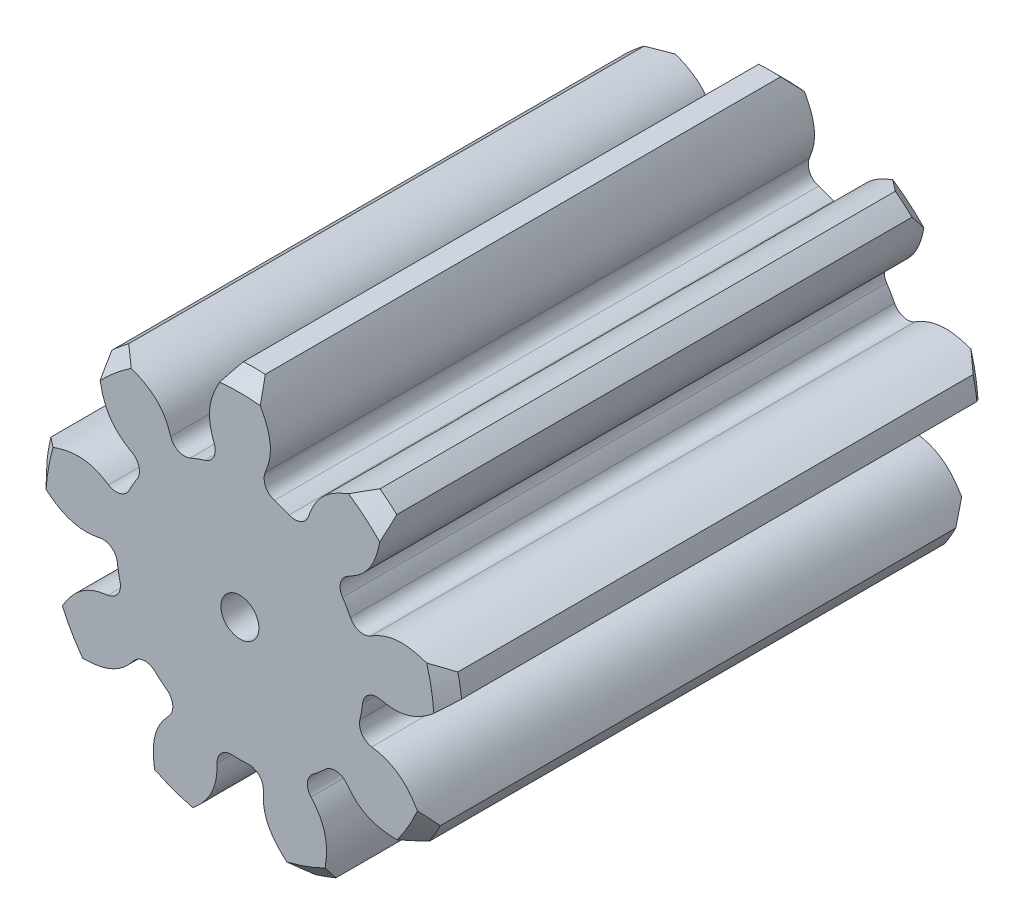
SolidWorks part; units mm, degrees
ref_plane "Plan1" through (0, 0, 0) normal (0, 0, 1) x (1, 0, 0)
ref_plane "Plan2" through (0, 0, 0) normal (0, 1, 0) x (1, 0, 0)
ref_plane "Plan3" through (0, 0, 0) normal (1, 0, 0) x (0, 0, -1)
sketch "Dent" plane through (0, 0, 0) normal (0, 0, 1) x (1, 0, 0)
  line L1 (-0.4322, 4.2181) -> (0, 3.0307)
  line L3 (0, 8.25) -> (0, -8.25) construction
  line L4 (0, 0) -> (0.4322, 8.2387) construction
  line L5 (1.1781, 6.6464) -> (-1.1781, 6.6464) construction
  line L6 (1.2, 6.2284) -> (-1.2, 6.2284) construction
  line L7 (-0.75, 0) -> (0.75, 0) construction
  line L9 (0.4322, 4.2181) -> (0, 3.0307)
  line L11 (0, 0) -> (1.1781, 6.6464) construction
  line L12 (0, 0) -> (1.2, 6.2284) construction
  circle A0 centre (0, 0) radius 6.75 construction
  circle A1 centre (0, 0) radius 8.25 construction
  arc A2 (0.4322, 8.2387) -> (-0.4322, 8.2387) centre (0, 0) ccw
  circle A3 centre (0, 0) radius 6.3429 construction
  point P2 (-1.1781, 6.6464)
  point P3 (-1.2, 6.2284)
  point P19 (1.1781, 6.6464)
  point P20 (1.2, 6.2284)
sketch "Esquisse2" plane through (0, 0, 0) normal (0, 0, 1) x (1, 0, 0)
  circle A0 centre (0, 0) radius 4.875
extrude "Base-Extrusion" add sketch "Esquisse2" against normal blind 21.5
extrude "Boss.-Extru.1" add sketch "Dent" against normal blind 21.5
fillet "Congé1" radius 0.57 4 edges at (0.7028, 4.8241, -10.75) (-0.7325, 4.8197, -10.75)
chamfer "Chanfrein1" distance 0.57 angle 45 4 edges at (0, 8.25, -21.5) (0, 8.25, 0)
pattern_circular "Répétition circulaire1" count 9 over 360 about axis through (0, 0, -21.5) along (0, 0, 1) of "Chanfrein1", "Boss.-Extru.1", "Congé1"
sketch "Esquisse3" plane through (0, 0, 0) normal (0, 0, 1) x (1, 0, 0)
  circle A0 centre (0, 0) radius 0.75
  dimension "D1" = 1.5
extrude "Enlèv. mat.-Extru.1" cut sketch "Esquisse3" against normal through all
equation "\"Dp@Dent\" = \"Module@Dent\"*\"Nbr de dents@Répétition circulaire1\" "
equation "\"Dt@Dent\" = \"Module@Dent\"*(\"Nbr de dents@Répétition circulaire1\"+2)"
equation "\"Dpied@Esquisse2\" = \"Dp@Dent\"-(2.5*\"Module@Dent\")"
equation "\"Db@Dent\" = \"Dp@Dent\"*cos(\"Angle de pression@Dent\"*pi/180)"
equation "\"Ep au primitif@Dent\" =  (pi*\"Dp@Dent\"/2)/\"Nbr de dents@Répétition circulaire1\""
equation "\"D3@Dent\"=atn((Sin((sqr(((\"Dt@Dent\"/\"Db@Dent\")^2)-1))) -((sqr(((\"Dt@Dent\"/\"Db@Dent\")^2)-1)) * Cos((sqr(((\"Dt@Dent\"/\"Db@Dent\")^2)-1)))))/(Cos((sqr(((\"Dt@Dent\"/\"Db@Dent\")^2)-1))) +((sqr(((\"Dt@Dent\"/\"Db@"
equation "\"D4@Dent\"=atn((Sin((sqr(((\"Dp@Dent\"/\"Db@Dent\")^2)-1))) -((sqr(((\"Dp@Dent\"/\"Db@Dent\")^2)-1)) * Cos((sqr(((\"Dp@Dent\"/\"Db@Dent\")^2)-1)))))/(Cos((sqr(((\"Dp@Dent\"/\"Db@Dent\")^2)-1))) +((sqr(((\"Dp@Dent\"/\"Db@"
equation "\"D1@Congé1\" = \"Module@Dent\"*0.38"
equation "\"D1@Base-Extrusion\" = \"Epaisseur@Boss.-Extru.1\""
